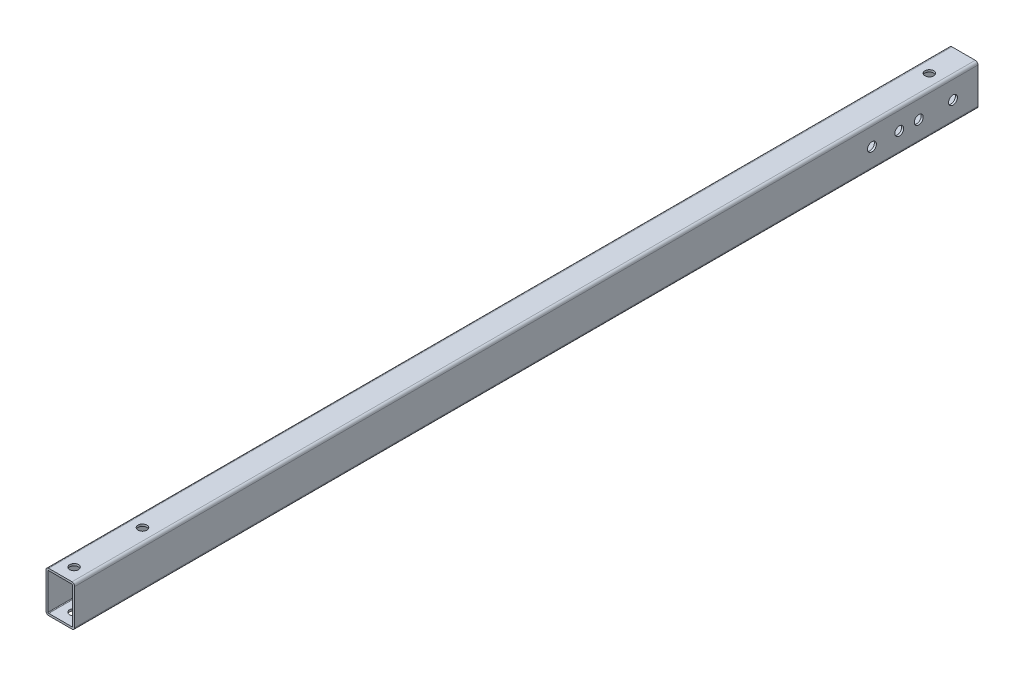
SolidWorks part; units mm, degrees
ref_plane "Plan1" through (0, 0, 0) normal (0, 0, 1) x (1, 0, 0)
ref_plane "Plan2" through (0, 0, 0) normal (0, 1, 0) x (1, 0, 0)
ref_plane "Plan3" through (0, 0, 0) normal (1, 0, 0) x (0, 0, -1)
sketch "Esquisse1" plane through (0, 0, 0) normal (0, 0, 1) x (1, 0, 0)
  line L0 (-77.5, -15) -> (-94.5, -15)
  line L1 (-55.6409, -15) -> (-94.5, -15) construction
  line L2 (-77, -13) -> (-77, 13)
  line L4 (-75.5, -13) -> (-75.5, 13)
  line L5 (-94.5, 15) -> (-55.6409, 15) construction
  line L6 (-96.5, -13) -> (-96.5, 13)
  line L7 (-77.5, 15) -> (-94.5, 15)
  line L8 (-77.5, 13.5) -> (-94.5, 13.5)
  line L9 (-95, -13) -> (-95, 13)
  line L10 (-77.5, -13.5) -> (-94.5, -13.5)
  line L14 (0, -44.75) -> (0, 44.75) construction
  arc A0 (-94.5, -15) -> (-96.5, -13) centre (-94.5, -13) cw
  arc A1 (-75.5, -13) -> (-77.5, -15) centre (-77.5, -13) cw
  arc A2 (-77.5, 15) -> (-75.5, 13) centre (-77.5, 13) cw
  arc A3 (-96.5, 13) -> (-94.5, 15) centre (-94.5, 13) cw
  arc A4 (-77.5, 13.5) -> (-77, 13) centre (-77.5, 13) cw
  arc A5 (-95, 13) -> (-94.5, 13.5) centre (-94.5, 13) cw
  arc A6 (-94.5, -13.5) -> (-95, -13) centre (-94.5, -13) cw
  arc A7 (-77, -13) -> (-77.5, -13.5) centre (-77.5, -13) cw
  point P11 (-96.5, -15)
  point P15 (-75.5, -15)
  point P18 (-75.5, 15)
  dimension "D3" = 2
  dimension "D1" = 75.5
  dimension "D2" = 21
  dimension "D4" = 1.5
extrude "Base-Extrusion" add sketch "Esquisse1" against normal blind 660
sketch "Esquisse2" plane through (-75.5, 0, 0) normal (1, 0, 0) x (0, 0, -1)
  line L0 (660, -13) -> (660, 13) construction
  line L1 (650, 0) -> (591, 0) construction
  line L2 (674.6058, 0) -> (106.7748, 0) construction
  line L3 (660, 13) -> (660, -13) construction
  circle A2 centre (641.7106, 0) radius 3.25
  circle A3 centre (616.7106, 0) radius 3.25
  circle A4 centre (602.5, 0) radius 3.25
  circle A5 centre (582.5, 0) radius 3.25
  dimension "D1" = 57.5
  dimension "D3" = 6.5
  dimension "D2" = 77.5
  dimension "D4" = 18.2894
  dimension "D5" = 43.2894
extrude "Enlèv. mat.-Extru.1" cut sketch "Esquisse2" against normal blind 47.5
sketch "Esquisse4" plane through (0, 15, 0) normal (0, 1, 0) x (-1, 0, 0)
  circle A0 centre (86, -10) radius 3.25 construction
  circle A1 centre (86, -60) radius 3.25 construction
  circle A2 centre (86, -10) radius 3.25
  circle A3 centre (86, -60) radius 3.25
extrude "Enlèv. mat.-Extru.2" cut sketch "Esquisse4" against normal through all
sketch "Esquisse6" plane through (0, 15, 0) normal (0, 1, 0) x (-1, 0, 0)
  line L0 (86, -660) -> (86, -605) construction
  line L1 (77.5, -660) -> (94.5, -660) construction
  circle A0 centre (86, -635) radius 3.25
  dimension "D1" = 6.5
  dimension "D2" = 25
extrude "Enlèv. mat.-Extru.3" cut sketch "Esquisse6" against normal through all
